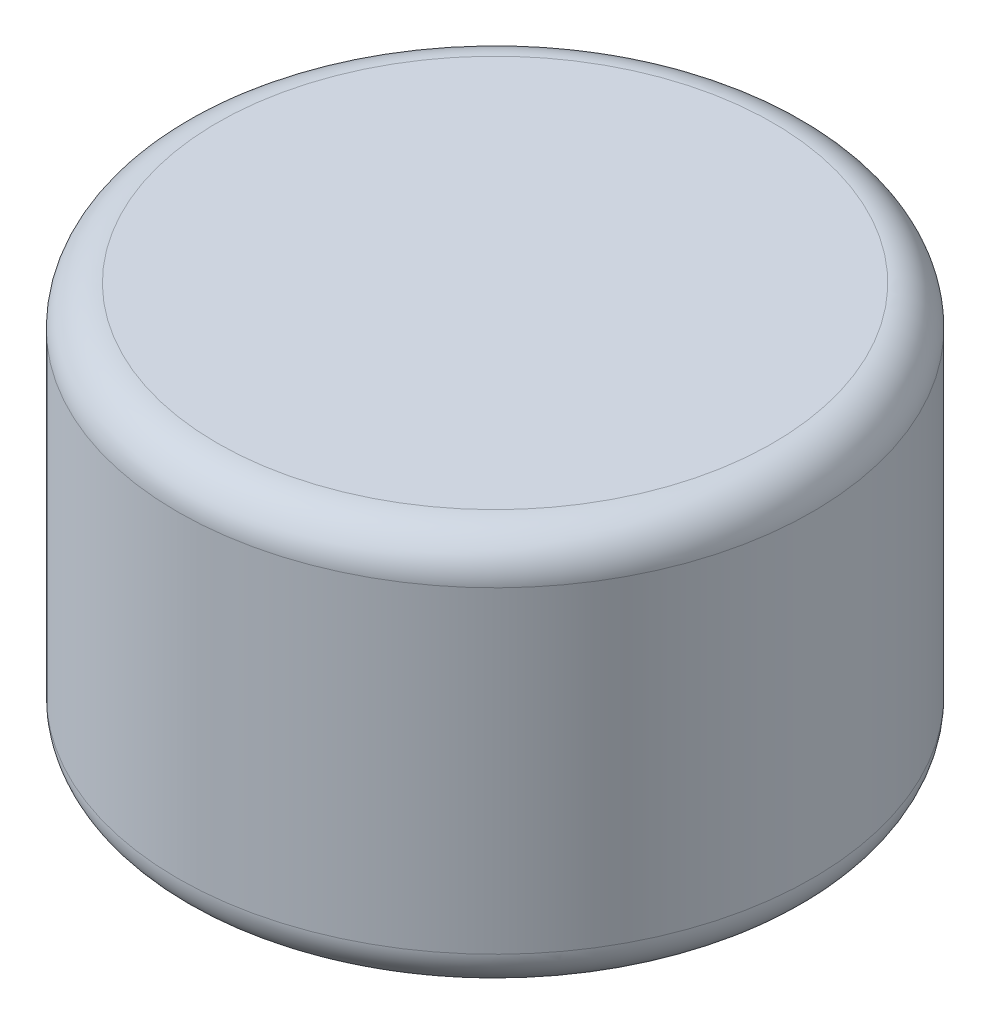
SolidWorks part; units mm, degrees
ref_plane "Face" through (0, 0, 0) normal (0, 0, 1) x (1, 0, 0)
ref_plane "Dessus" through (0, 0, 0) normal (0, 1, 0) x (1, 0, 0)
ref_plane "Droite" through (0, 0, 0) normal (1, 0, 0) x (0, 0, -1)
sketch "Esquisse1" plane through (0, 0, 0) normal (0, 1, 0) x (1, 0, 0)
  circle A0 centre (0, 0) radius 4
extrude "Extrusion1" add sketch "Esquisse1" along normal blind 5
fillet "Congé1" radius 0.5 2 edges at (0, 0, 4) (0, 5, 4)
